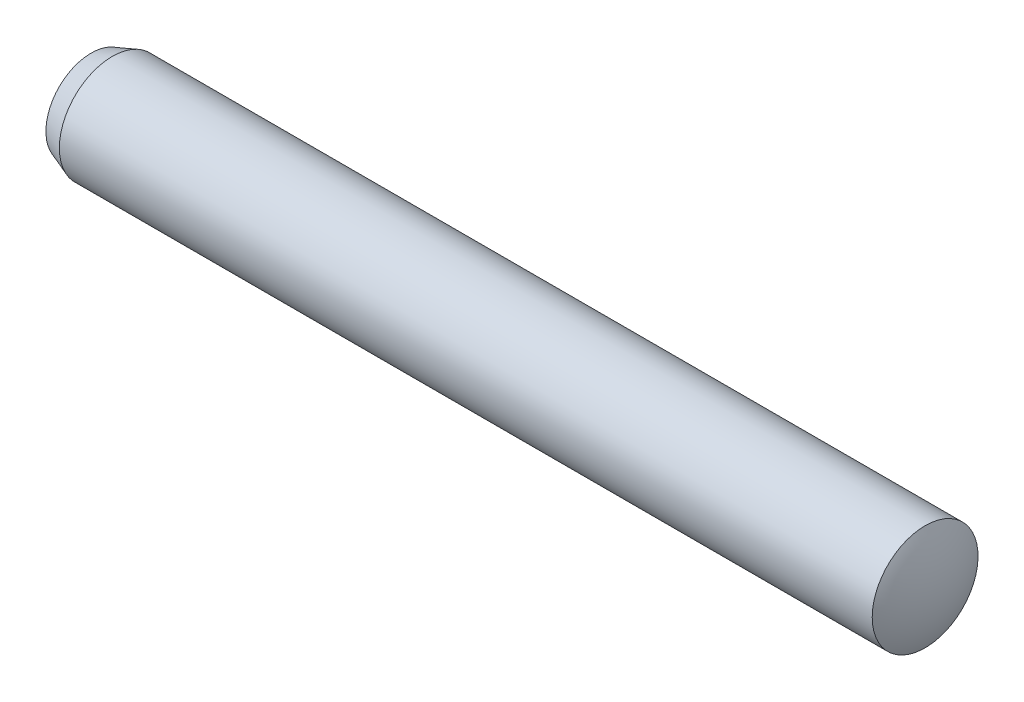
SolidWorks part; units mm, degrees
ref_plane "Plan1" through (0, 0, 0) normal (0, 0, 1) x (1, 0, 0)
ref_plane "Plan2" through (0, 0, 0) normal (0, 1, 0) x (1, 0, 0)
ref_plane "Plan3" through (0, 0, 0) normal (1, 0, 0) x (0, 0, -1)
sketch "Esquisse1" plane through (0, 0, 0) normal (0, 0, 1) x (1, 0, 0)
  line L0 (0, 0) -> (0, 4.2721)
  line L1 (0, 4.2721) -> (2, 5)
  line L2 (2, 5) -> (78.8, 5)
  line L3 (0, 0) -> (80, 0) construction
  line L4 (0, 0) -> (80, 0)
  arc A0 (78.8, 5) -> (80, 0) centre (68.9833, 0) cw
  dimension "D1" = 80
  dimension "D2" = 5
  dimension "D3" = 1.2
  dimension "D4" = 2
  dimension "D5" = 20
revolve "Base-Révolution" add sketch "Esquisse1" angle 360 about L3
